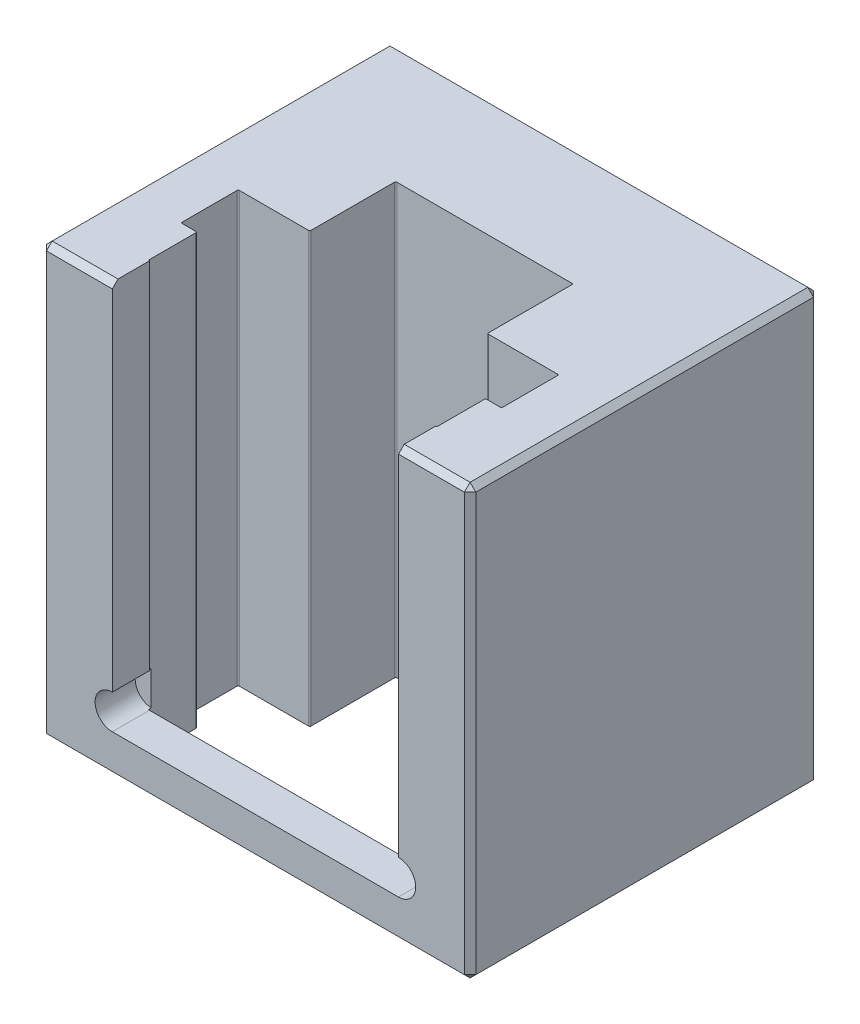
SolidWorks part; units mm, degrees
ref_plane "Plan de face" through (0, 0, 0) normal (0, 0, 1) x (1, 0, 0)
ref_plane "Plan de dessus" through (0, 0, 0) normal (0, 1, 0) x (1, 0, 0)
ref_plane "Plan de droite" through (0, 0, 0) normal (1, 0, 0) x (0, 0, -1)
sketch "Esquisse1" plane through (0, 0, 0) normal (0, 0, 1) x (1, 0, 0)
  line L1 (-37.5, 37.5) -> (37.5, 37.5)
  line L2 (-37.5, 37.5) -> (-37.5, -37.5)
  line L3 (-37.5, -37.5) -> (37.5, -37.5)
  line L4 (37.5, 37.5) -> (37.5, -37.5)
  dimension "D1" = 75
  dimension "D2" = 75
  dimension "D3" = 37.5
  dimension "D4" = 37.5
extrude "Bloc de base 75 x75 ep 61" add sketch "Esquisse1" along normal blind 61
chamfer "Cassages d'angles bloc" distance 1 angle 45 12 edges at (0, 37.5, 61) (37.5, 0, 61) (0, -37.5, 61) (-37.5, 0, 61) (0, -37.5, 0) (37.5, -37.5, 30.5) (37.5, 0, 0) (37.5, 37.5, 30.5) (0, 37.5, 0) (-37.5, -37.5, 30.5) (-37.5, 0, 0) (-37.5, 37.5, 30.5)
sketch "Esquisse2" plane through (0, 37.5, 0) normal (0, 1, 0) x (1, 0, 0)
  line L1 (-28, -46) -> (-25.2, -46)
  line L2 (-28, -46) -> (-28, -36)
  line L3 (-28, -36) -> (-15.5, -36)
  line L4 (28, -46) -> (28, -36)
  line L5 (37.5, -61) -> (-37.5, -61) construction
  line L6 (0, 0) -> (0, -61) construction
  line L7 (-15.5, -36) -> (-15.5, -21)
  line L8 (-15.5, -21) -> (15.5, -21)
  line L9 (15.5, -21) -> (15.5, -36)
  line L10 (15.5, -36) -> (28, -36)
  line L11 (25.2, -46) -> (28, -46)
  line L13 (-25.2, -46) -> (-25.2, -54.5)
  line L14 (-25.2, -54.5) -> (25.2, -54.5)
  line L15 (25.2, -46) -> (25.2, -54.5)
  dimension "D1" = 25
  dimension "D2" = 56
  dimension "D3" = 10
  dimension "D4" = 15
  dimension "D5" = 31
  dimension "D6" = 50.4
  dimension "D7" = 6.5
extrude "Ouverture passage cassette" cut sketch "Esquisse2" against normal through all
sketch "Esquisse3" plane through (0, 0, 61) normal (0, 0, 1) x (1, 0, 0)
  line L0 (37.5, 37.5) -> (-37.5, 37.5) construction
  line L1 (-25, 37.5) -> (25, 37.5)
  line L2 (-25, 37.5) -> (-25, -30.5)
  line L3 (-25, -30.5) -> (25, -30.5)
  line L4 (25, 37.5) -> (25, -30.5)
  line L5 (-37.5, -37.5) -> (37.5, -37.5) construction
  line L6 (0, 0) -> (0, 37.5) construction
  dimension "D1" = 7
  dimension "D2" = 50
extrude "Ouverture positionnement empreinte" cut sketch "Esquisse3" against normal up to surface (6.5 mm away)
fillet "cassages d'angles cassette" radius 0.2 12 edges at (25.2, 0, 46) (28, 0, 46) (28, 0, 36) (15.5, 0, 36) (15.5, 0, 21) (-15.5, 0, 21) (-15.5, 0, 36) (-28, 0, 36) (-28, 0, 46) (-25.2, 0, 46) (25.2, 0, 54.5) (-25.2, 0, 54.5)
sketch "Esquisse4" plane through (0, 0, 61) normal (0, 0, 1) x (1, 0, 0)
  line L0 (-25, 36.5) -> (-25, -30.5) construction
  line L1 (25, -30.5) -> (25, 36.5) construction
  line L2 (-25, -30.5) -> (25, -30.5) construction
  circle A0 centre (-25, -27.5) radius 3
  circle A1 centre (25, -27.5) radius 3
  dimension "D1" = 6
extrude "Dégagements pour butée cassette" cut sketch "Esquisse4" against normal blind 7
sketch "Esquisse5" plane through (0, 0, 0) normal (0, 0, -1) x (-1, 0, 0)
  circle A0 centre (0, 0) radius 5
  dimension "D1" = 10
extrude "passage tige d'éjection" cut sketch "Esquisse5" against normal through all
sketch "Esquisse10" plane through (0, 0, 21) normal (0, 0, 1) x (1, 0, 0)
  circle A0 centre (0, 0) radius 7
  dimension "D1" = 14
extrude "Enlèv. mat.-Extru.1" cut sketch "Esquisse10" against normal blind 5.2
chamfer "Chanfrein1" distance 0.5 angle 45 1 edges at (7, 0, 21)
chamfer "Chanfrein2" distance 0.5 angle 45 1 edges at (5, 0, 15.8)
hole_wizard "Trous taraudés M6 de fixation" positions "Esquisse9" profile "Esquisse8" tap size "M6" standard "Iso"
sketch "Esquisse9" plane through (0, 0, 0) normal (0, 0, -1) x (-1, 0, 0)
  line L0 (-37.5, -36.5) -> (-37.5, 36.5) construction
  line L1 (-36.5, 37.5) -> (36.5, 37.5) construction
  point P0 (-31.5, 31.5)
  dimension "D1" = 6
  dimension "D2" = 6
sketch "Esquisse8" plane through (31.5, 31.5, 0) normal (1, 0, 0) x (0, 1, 0)
  line L0 (0, 0) -> (0, 31.5022)
  line L1 (0, 31.5022) -> (2.5, 30)
  line L2 (2.5, 30) -> (2.5, 1)
  line L3 (2.5, 1) -> (3.5, 0)
  line L5 (3.5, 0) -> (0, 0)
  line L6 (-2.5, 1) -> (-3.5, 0) construction
  line L10 (0, 31.5022) -> (-2.5, 30) construction
  line L11 (0, -6.35) -> (0, 107.95) construction
  dimension "Diamètre du trou pour taraudage" = 5
  dimension "Profondeur du trou pour taraudage" = 30
  dimension "Diamètre du fraisage entrant" = 7
  dimension "Angle du fraisage entrant" = 90
  dimension "Angle de pointe" = 118
pattern_linear "Répétition linéaire1" count 2 spacing 63 along (-1, 0, 0) count 2 spacing 63 along (0, -1, 0) of "Trous taraudés M6 de fixation"
